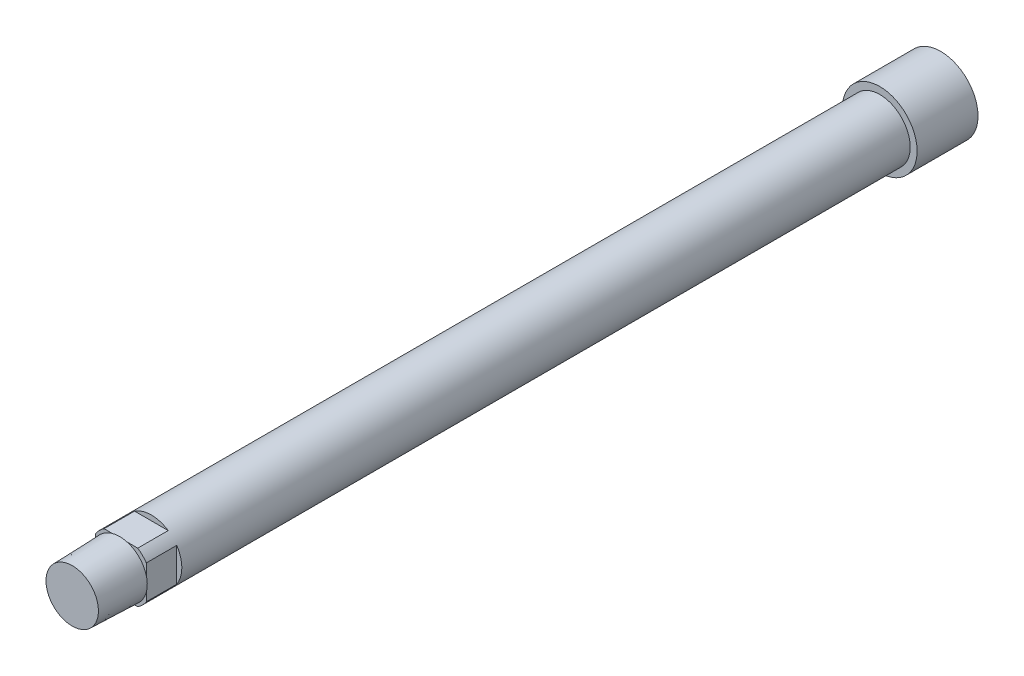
SolidWorks part; units mm, degrees
ref_plane "Front" through (0, 0, 0) normal (0, 0, 1) x (1, 0, 0)
ref_plane "Top" through (0, 0, 0) normal (0, 1, 0) x (1, 0, 0)
ref_plane "Right" through (0, 0, 0) normal (1, 0, 0) x (0, 0, -1)
sketch "Sketch1" plane through (0, 0, 0) normal (0, 0, 1) x (1, 0, 0)
  circle A0 centre (0, 0) radius 9.525
  circle A1 centre (0, 0) radius 6.35
  dimension "D1" = 19.05
  dimension "D2" = 12.7
extrude "Base-Extrude" add sketch "Sketch1" along normal blind 252.6284
sketch "Sketch8" plane through (0, 0, 0) normal (0, 0, -1) x (-1, 0, 0)
  circle A0 centre (0, 0) radius 7.62
  dimension "D1" = 15.24
extrude "Cut-Extrude4" cut sketch "Sketch8" against normal blind 7.62
sketch "Sketch9" plane through (0, 0, 0) normal (1, 0, 0) x (0, 0, -1)
  line L0 (-251.9934, 8.3578) -> (-251.9934, 5.0982) construction
  line L1 (-252.6284, 9.525) -> (-252.6284, -9.525) construction
  line L2 (-252.6284, 7.2136) -> (-251.9934, 8.3509)
  line L3 (-251.9934, 8.3509) -> (-251.3584, 7.2531)
  line L4 (-252.6284, 7.2136) -> (-252.6284, 9.525)
  line L5 (-252.6284, 9.525) -> (-237.3884, 9.525)
  line L6 (-252.6284, 0) -> (-116.2585, 0) construction
  line L7 (-237.3884, 9.525) -> (-237.3884, 7.6872)
  line L8 (-252.6284, 7.7724) -> (-90.8322, 12.8005) construction
  line L9 (-252.6284, -13.1284) -> (-252.6284, 7.2136) construction
  line L10 (-252.6284, 7.2136) -> (-237.3884, 7.6872) construction
  line L11 (-252.6284, 8.3312) -> (-237.3884, 8.8048) construction
  line L12 (-251.3584, 7.2531) -> (-250.7234, 8.3904)
  line L13 (-250.7234, 8.3904) -> (-250.0884, 7.2925)
  line L14 (-250.0884, 7.2925) -> (-249.4534, 8.4299)
  line L15 (-249.4534, 8.4299) -> (-248.8184, 7.332)
  line L16 (-248.8184, 7.332) -> (-248.1834, 8.4693)
  line L17 (-248.1834, 8.4693) -> (-247.5484, 7.3715)
  line L18 (-247.5484, 7.3715) -> (-246.9134, 8.5088)
  line L19 (-246.9134, 8.5088) -> (-246.2784, 7.4109)
  line L20 (-246.2784, 7.4109) -> (-245.6434, 8.5483)
  line L21 (-245.6434, 8.5483) -> (-245.0084, 7.4504)
  line L22 (-245.0084, 7.4504) -> (-244.3734, 8.5877)
  line L23 (-244.3734, 8.5877) -> (-243.7384, 7.4899)
  line L24 (-243.7384, 7.4899) -> (-243.1034, 8.6272)
  line L25 (-243.1034, 8.6272) -> (-242.4684, 7.5293)
  line L26 (-242.4684, 7.5293) -> (-241.8334, 8.6667)
  line L27 (-241.8334, 8.6667) -> (-241.1984, 7.5688)
  line L28 (-241.1984, 7.5688) -> (-240.5634, 8.7061)
  line L29 (-240.5634, 8.7061) -> (-239.9284, 7.6083)
  line L30 (-239.9284, 7.6083) -> (-239.2934, 8.7456)
  line L31 (-239.2934, 8.7456) -> (-238.6584, 7.6477)
  line L32 (-238.6584, 7.6477) -> (-238.0234, 8.7851)
  line L33 (-238.0234, 8.7851) -> (-237.3884, 7.6872)
  line L34 (0, 9.525) -> (-252.6284, 9.525) construction
  dimension "D1" = 15.24
  dimension "D2" = 1.78
  dimension "D3" = 15.5448
  dimension "D4" = 14.4272
  dimension "D5" = 180
  dimension "D6" = 16.6624
  dimension "D7" = 180
  dimension "D8" = 1.27
  dimension "D9" = 0.635
  dimension "D10" = 1.905
  dimension "D11" = 2.54
  dimension "D12" = 3.81
  dimension "D13" = 5.08
  dimension "D14" = 6.35
  dimension "D15" = 7.62
  dimension "D16" = 8.89
  dimension "D17" = 10.16
  dimension "D18" = 11.43
  dimension "D19" = 12.7
  dimension "D20" = 13.97
  dimension "D21" = 14.605
  dimension "D22" = 13.335
  dimension "D23" = 12.065
  dimension "D24" = 10.795
  dimension "D25" = 9.525
  dimension "D26" = 8.255
  dimension "D27" = 6.985
  dimension "D28" = 5.715
  dimension "D29" = 4.445
  dimension "D30" = 3.175
revolve "Cut-Revolve1" cut sketch "Sketch9" angle 360 about L6
sketch "Sketch10" plane through (0, 0, 0) normal (1, 0, 0) x (0, 0, -1)
  line L0 (-252.6284, 9.525) -> (-237.3884, 9.525)
  line L1 (-237.3884, 9.525) -> (-237.3884, 8.5725)
  line L2 (-237.3884, 9.525) -> (-237.3884, -9.525) construction
  line L3 (-252.6284, 0) -> (-90.4202, 0) construction
  line L4 (-252.6284, 7.2136) -> (-252.6284, -7.2136) construction
  line L5 (-237.3884, 8.5725) -> (-240.7752, 8.5725)
  line L6 (-240.7752, 8.5725) -> (-252.6284, 8.2041)
  line L7 (-252.6284, 8.2041) -> (-252.6284, 9.525)
  line L8 (-252.6284, 0) -> (-119.8446, 0) construction
  line L9 (0, 9.525) -> (-237.3884, 9.525) construction
  dimension "D1" = 1.78
  dimension "D2" = 8.5725
  dimension "D3" = 0.127
revolve "Cut-Revolve2" cut sketch "Sketch10" angle 360 about L8
sketch "Sketch11" plane through (0, 0, 237.3884) normal (0, 0, 1) x (1, 0, 0)
  line L1 (-7.9375, -7.9375) -> (7.9375, -7.9375)
  line L2 (-7.9375, -7.9375) -> (-7.9375, 7.9375)
  line L3 (-7.9375, 7.9375) -> (7.9375, 7.9375)
  line L4 (7.9375, -7.9375) -> (7.9375, 7.9375)
  circle A0 centre (0, 0) radius 12.7
  dimension "D5" = 25.4
  dimension "D1" = 15.875
  dimension "D2" = 15.875
  dimension "D3" = 7.9375
  dimension "D4" = 7.9375
extrude "Cut-Extrude5" cut sketch "Sketch11" against normal blind 9.525
ref_plane "Plane5" through (9.525, 0, 0) normal (1, 0, 0) x (0, 0, -1)
sketch "Sketch12" plane through (9.525, 0, 0) normal (1, 0, 0) x (0, 0, -1)
  line L0 (0, -9.525) -> (0, 9.525) construction
  circle A0 centre (-15.875, 0) radius 2.4765
  dimension "D1" = 4.953
  dimension "D2" = 15.875
extrude "Cut-Extrude6" [suppressed] cut sketch "Sketch12" against normal blind 2.286
pattern_circular "CirPattern2" [suppressed] count 4 over 360
sketch "Sketch13" plane through (0, 0, 0) normal (1, 0, 0) x (0, 0, -1)
  line L0 (-252.6284, 8.2041) -> (-237.809, 8.6647)
  line L1 (-236.4702, 6.35) -> (-237.809, 8.6647)
  line L2 (-237.3884, 7.6872) -> (-237.9004, 8.5725) construction
  line L3 (-249.3812, 8.3051) -> (-249.5256, 8.3006) construction
  line L4 (-251.9212, 8.2261) -> (-252.0656, 8.2216) construction
  line L5 (-105.3199, 0) -> (8.9756, 0) construction
  line L8 (-252.6284, 8.2041) -> (-252.6284, 0)
  line L9 (-252.6284, 7.2136) -> (-252.6284, -7.2136) construction
  line L10 (-7.62, 6.35) -> (-252.6284, 6.35) construction
  line L11 (-252.6284, 0) -> (0, 0)
  line L12 (0, 0) -> (0, 7.62)
  line L13 (0, 7.62) -> (-7.62, 7.62)
  line L14 (-7.62, 7.62) -> (-7.62, 6.35)
  line L15 (-7.62, 6.35) -> (-236.4702, 6.35)
revolve "WEB Revolve1" add sketch "Sketch13" angle 360 about L5
sketch "Sketch14" plane through (0, 0, 0) normal (0, 0, -1) x (-1, 0, 0)
  circle A0 centre (0, 0) radius 11.684
  dimension "D1" = 23.368
extrude "WEB Extrude1" add sketch "Sketch14" along normal blind 19.05
